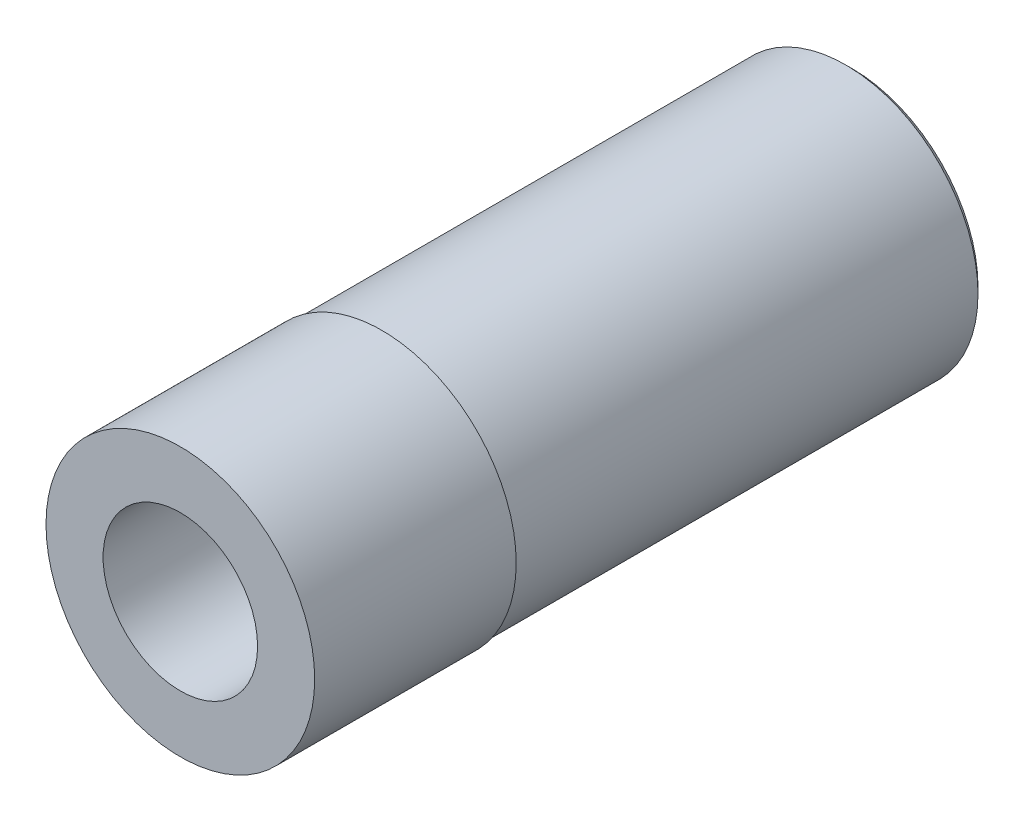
SolidWorks part; units mm, degrees
ref_plane "Front Plane" through (0, 0, 0) normal (0, 0, 1) x (1, 0, 0)
ref_plane "Top Plane" through (0, 0, 0) normal (0, 1, 0) x (1, 0, 0)
ref_plane "Right Plane" through (0, 0, 0) normal (1, 0, 0) x (0, 0, -1)
sketch "Sketch1" plane through (0, 0, 0) normal (1, 0, 0) x (0, 0, -1)
  line L2 (0, 4) -> (0, 2.3)
  line L3 (19.75, 4) -> (0, 4)
  line L4 (-3.7979, 0) -> (49996.2021, 0) construction
  line L8 (16, 1.25) -> (4, 1.25)
  line L9 (4, 2.3) -> (4, 1.25)
  line L10 (4, 2.3) -> (0, 2.3)
  line L12 (20, 2) -> (20, 3.75)
  line L16 (20, 3.75) -> (19.75, 4)
  line L17 (20, 2) -> (16, 2)
  line L18 (16, 1.25) -> (16, 2)
  dimension "D1" = 20
  dimension "D2" = 45
  dimension "D3" = 0.25
  dimension "D4" = 8
  dimension "D5" = 4.6
  dimension "D6" = 4
  dimension "D7" = 2.5
  dimension "D8" = 4
  dimension "D9" = 4
revolve "Revolve1" add sketch "Sketch1" angle 360 about L4
sketch "Sketch4" plane through (0, 0, 0) normal (1, 0, 0) x (0, 0, -1)
  line L0 (0, 0) -> (50000, 0) construction
  line L1 (20, -3.75) -> (20, 3.75) construction
  line L2 (6, 4.935) -> (20, 4.935)
  line L3 (6, 4.935) -> (6, 3.935)
  line L4 (6, 3.935) -> (20, 3.935)
  line L5 (20, 4.935) -> (20, 3.935)
  line L6 (19.75, 4) -> (0, 4) construction
  line L9 (0, 55) -> (0, -55) construction
  dimension "D1" = 1
  dimension "D2" = 0.065
  dimension "D3" = 6
revolve "Cut-Revolve1" cut sketch "Sketch4" angle 360 about L0
sketch "Sketch3" plane through (0, 0, -4) normal (0, 0, 1) x (1, 0, 0)
  line L0 (0, 0) -> (0, 50000) construction
  line L1 (0.7217, 1.25) -> (-0.7217, 1.25)
  line L2 (-0.7217, 1.25) -> (-1.4434, 0)
  line L3 (-1.4434, 0) -> (-0.7217, -1.25)
  line L4 (-0.7217, -1.25) -> (0.7217, -1.25)
  line L5 (0.7217, -1.25) -> (1.4434, 0)
  line L6 (1.4434, 0) -> (0.7217, 1.25)
  line L7 (0, 0) -> (50000, 0) construction
  circle A0 centre (0, 0) radius 1.25 construction
  circle A1 centre (0, 0) radius 1.25 construction
extrude "Cut-Extrude2" cut sketch "Sketch3" against normal blind 2
